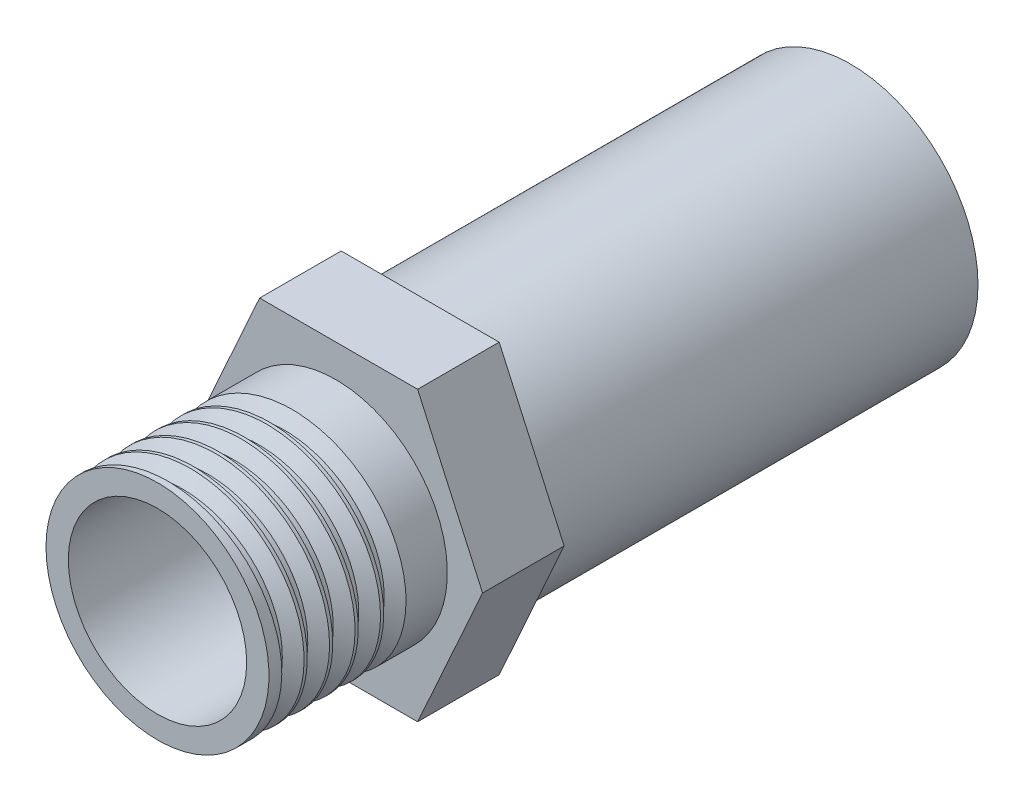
SolidWorks part; units mm, degrees
ref_plane "Front Plane" through (0, 0, 0) normal (0, 0, 1) x (1, 0, 0)
ref_plane "Top Plane" through (0, 0, 0) normal (0, 1, 0) x (1, 0, 0)
ref_plane "Right Plane" through (0, 0, 0) normal (1, 0, 0) x (0, 0, -1)
ref_plane "Plane1" through (0, 0, -3.2) normal (0, 0, -1) x (-1, 0, 0)
sketch "Sketch1" plane through (0, 0, -3.2) normal (0, 0, -1) x (-1, 0, 0)
  line L0 (-3.2086, -5.6513) -> (2.9914, -5.6513)
  line L1 (2.9914, -5.6513) -> (5.5414, 0)
  line L2 (5.5414, 0) -> (2.9914, 5.6513)
  line L3 (2.9914, 5.6513) -> (-3.2086, 5.6513)
  line L4 (-3.2086, 5.6513) -> (-5.7586, 0)
  line L5 (-5.7586, 0) -> (-3.2086, -5.6513)
extrude "Boss-Extrude1" add sketch "Sketch1" against normal blind 3.2
ref_plane "Plane2" through (0, 0, 0) normal (0, -1, 0) x (1, 0, 0)
sketch "Sketch2" plane through (0, 0, 0) normal (0, -1, 0) x (1, 0, 0)
  line L0 (4.375, 7) -> (0, 7)
  line L1 (0, 7) -> (0, 0)
  line L2 (0, 0) -> (4.375, 0)
  line L3 (4.375, 0) -> (4.375, 7)
  line L4 (0, 7) -> (0, 0) construction
revolve "Revolve1" add sketch "Sketch2" angle 360 about L4
sketch "Sketch3" plane through (0, 0, 0) normal (0, 1, 0) x (1, 0, 0)
  line L0 (5, 20.2) -> (0, 20.2)
  line L1 (0, 20.2) -> (0, 3.2)
  line L2 (0, 3.2) -> (5, 3.2)
  line L3 (5, 3.2) -> (5, 20.2)
  line L4 (0, 20.2) -> (0, 3.2) construction
revolve "Revolve2" add sketch "Sketch3" angle 360 about L4
sketch "Sketch4" plane through (0, 0, 0) normal (0, -1, 0) x (1, 0, 0)
  line L0 (3.5, 7) -> (0, 7)
  line L1 (0, 7) -> (0, -20.2)
  line L2 (0, -20.2) -> (4, -20.2)
  line L3 (4, -20.2) -> (4, -3.066)
  line L4 (3.5, -2.2) -> (3.5, 7)
  line L5 (0, 7) -> (0, -20.2) construction
  arc A0 (4, -3.066) -> (3.5, -2.2) centre (4.5, -2.2) cw
revolve "Cut-Revolve1" cut sketch "Sketch4" angle 360 about L5
thread "Thread1" pitch 1 start angle 0, offset 0, length 5, pitch 1, diameter 8.75
ref_plane "Plane3" through (-4.375, 0, 7) normal (0, -1, 0) x (-1, 0, 0)
sketch "Thread Profile1" plane through (-4.375, 0, 7) normal (0, -1, 0) x (-1, 0, 0)
  line L0 (0, 0) -> (0, 1) construction
  line L11 (0, 0) -> (0, 0.875)
  line L12 (0, 0.875) -> (-0.5413, 0.5625)
  line L13 (-0.5413, 0.5625) -> (-0.5413, 0.3125)
  line L15 (-0.5413, 0.3125) -> (0, 0)
  line L17 (-0.5413, 0.4375) -> (0, 0.4375) construction
  point P2 (0, 0)
  dimension "Pitch" = 1
  dimension "Profile_Angle" = 60
  dimension "Profile_Land" = 0.25
  dimension "Profile_Height" = 0.5413
equation "\"5mmmm\"=8"
